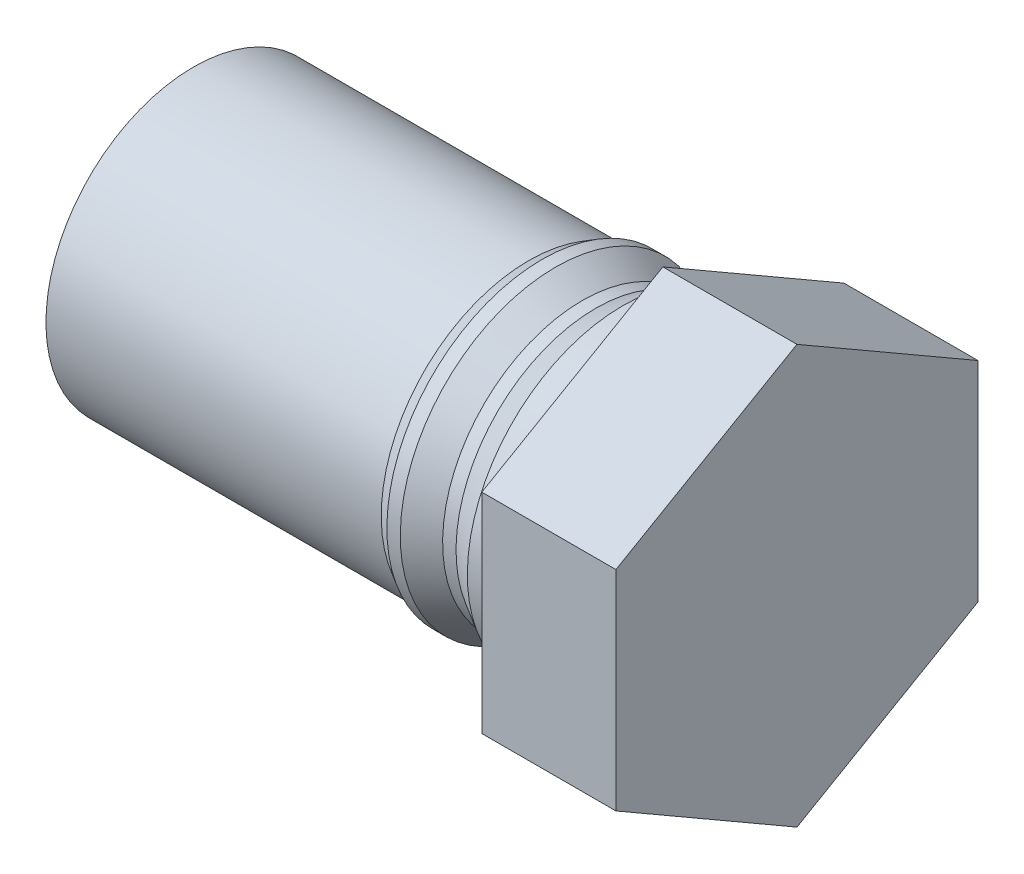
SolidWorks part; units mm, degrees
ref_plane "Alzado" through (0, 0, 0) normal (0, 0, 1) x (1, 0, 0)
ref_plane "Planta" through (0, 0, 0) normal (0, 1, 0) x (1, 0, 0)
ref_plane "Vista lateral" through (0, 0, 0) normal (1, 0, 0) x (0, 0, -1)
sketch "Croquis1" plane through (0, 0, 0) normal (0, 0, 1) x (1, 0, 0)
  line L0 (0, 0) -> (35, 0) construction
  line L1 (0, 0) -> (0, 11)
  line L2 (0, 11) -> (25, 11)
  line L3 (25, 11) -> (26, 11.5774)
  line L4 (26, 11.5774) -> (27, 11.5774)
  line L5 (26.5, 11.5774) -> (26.5, 0) construction
  line L6 (28, 11) -> (27, 11.5774)
  line L7 (28, 11) -> (29, 10.4226)
  line L8 (29, 10.4226) -> (30, 10.4226)
  line L9 (29.5, 10.4226) -> (29.5, 0) construction
  line L10 (31, 11) -> (30, 10.4226)
  line L11 (31, 11) -> (32, 11.5774)
  line L12 (32, 11.5774) -> (35, 11.5774)
  line L13 (35, 11.5774) -> (35, 0)
  line L14 (35, 0) -> (0, 0)
  dimension "D1" = 22
  dimension "D2" = 25
  dimension "D3" = 1
  dimension "D4" = 1
  dimension "D5" = 150
  dimension "D6" = 1
  dimension "D7" = 1
  dimension "D8" = 3
revolve "Revolución1" add sketch "Croquis1" angle 360 about L14
sketch "Croquis4" plane through (35, 0, 0) normal (1, 0, 0) x (0, 0, -1)
  line L1 (0, 15.5885) -> (-13.5, 7.7942)
  line L2 (-13.5, 7.7942) -> (-13.5, -7.7942)
  line L3 (-13.5, -7.7942) -> (0, -15.5885)
  line L4 (0, -15.5885) -> (13.5, -7.7942)
  line L5 (13.5, -7.7942) -> (13.5, 7.7942)
  line L6 (13.5, 7.7942) -> (0, 15.5885)
  circle A0 centre (0, 0) radius 13.5 construction
  dimension "D1" = 27
extrude "Saliente-Extruir3" add sketch "Croquis4" along normal blind 10
